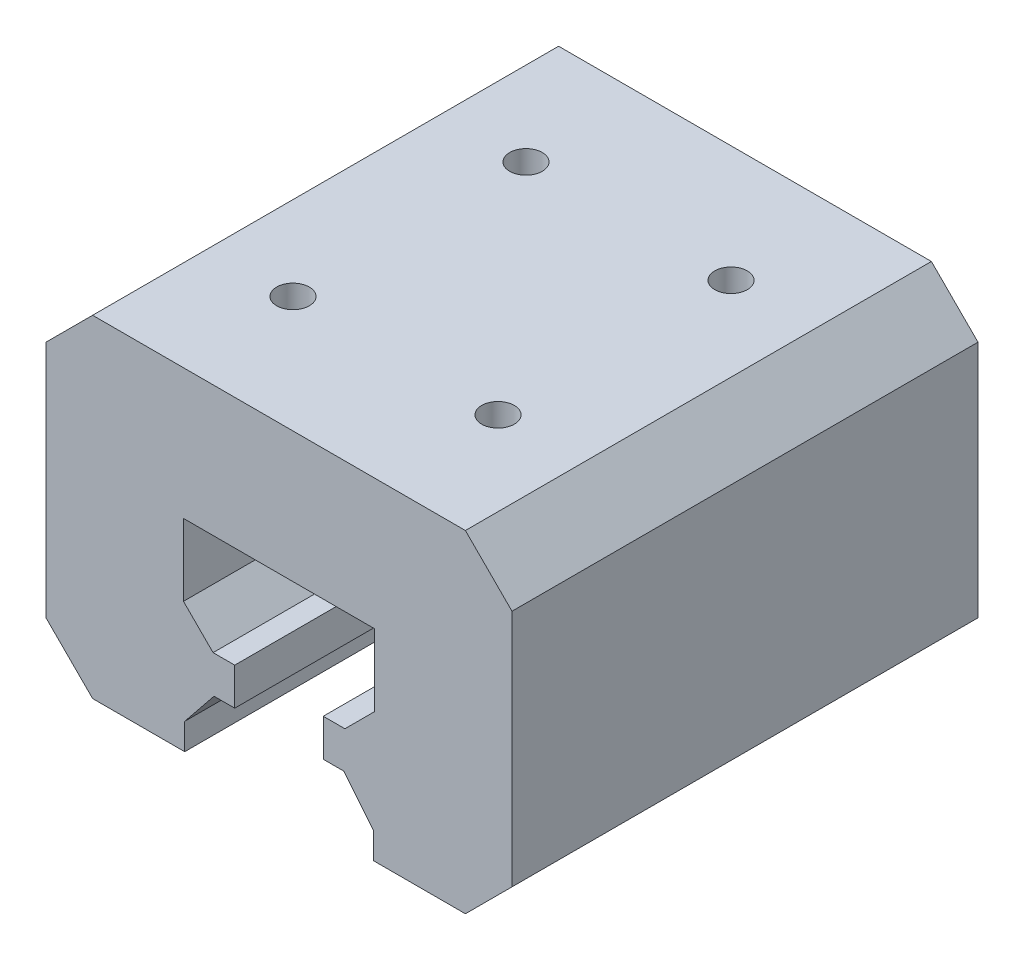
SolidWorks part; units mm, degrees
ref_plane "Płaszczyzna przednia" through (0, 0, 0) normal (0, 0, 1) x (1, 0, 0)
ref_plane "Płaszczyzna górna" through (0, 0, 0) normal (0, 1, 0) x (1, 0, 0)
ref_plane "Płaszczyzna prawa" through (0, 0, 0) normal (1, 0, 0) x (0, 0, -1)
sketch "Szkic2" plane through (0, 0, 0) normal (0, 0, 1) x (1, 0, 0)
  line L0 (-39.3077, 43.2312) -> (1.6923, 43.2312)
  line L1 (1.6923, 27.8169) -> (1.6923, 43.2312)
  line L2 (19.2, 43.2312) -> (-19.2, 43.2312) construction
  line L3 (-18.8077, 71.2312) -> (-18.8077, 43.2312) construction
  line L4 (31.1923, 71.2312) -> (-68.8077, 71.2312)
  line L5 (-68.8077, 71.2312) -> (-68.8077, 0)
  line L6 (-68.8077, 0) -> (-39.0438, 0)
  line L7 (-4.6627, 21.4619) -> (1.6923, 27.8169)
  line L8 (-9.3077, 21.4619) -> (-4.6627, 21.4619)
  line L9 (-9.3077, 13.4619) -> (-9.3077, 21.4619)
  line L10 (-4.862, 13.4619) -> (-9.3077, 13.4619)
  line L11 (1.4284, 5.6465) -> (-4.862, 13.4619)
  line L12 (1.4284, 0) -> (1.4284, 5.6465)
  line L13 (31.1923, 0) -> (1.4284, 0)
  line L14 (31.1923, 71.2312) -> (31.1923, 0)
  line L21 (-39.0438, -14.7059) -> (-39.0438, 5.2941)
  line L22 (-39.0438, 0) -> (-39.0438, 5.6465)
  line L24 (-38.8228, 5.9211) -> (-33.0536, 13.089)
  line L25 (-39.0438, 5.6465) -> (-32.7534, 13.4619)
  line L27 (-32.2746, 13.4619) -> (-27.3077, 13.4619)
  line L28 (-32.7534, 13.4619) -> (-28.3077, 13.4619)
  line L30 (-28.3077, 12.4619) -> (-28.3077, 22.4619)
  line L31 (-28.3077, 13.4619) -> (-28.3077, 21.4619)
  line L33 (-27.3077, 21.4619) -> (-32.5385, 21.4619)
  line L34 (-28.3077, 21.4619) -> (-32.9527, 21.4619)
  line L36 (-33.2456, 21.7548) -> (-39.0148, 27.5241)
  line L37 (-32.9527, 21.4619) -> (-39.3077, 27.8169)
  line L39 (-39.3077, 28.2312) -> (-39.3077, 43.2312)
  line L40 (-39.3077, 27.8169) -> (-39.3077, 43.2312)
  dimension "D2" = 41
  dimension "D3" = 1
  dimension "D4" = 28
  dimension "D5" = 100
  dimension "D6" = 71.2312
  dimension "D7" = 1
  dimension "D8" = 1
  dimension "D9" = 1
  dimension "D10" = 1
  dimension "D11" = 1
  dimension "D12" = 1
extrude "Dodanie-wyciągnięcie1" add sketch "Szkic2" along normal blind 100 contours L4 L5 L6 L22 L25 L28 L31 L34 L37 L40 L0 L1 L7 L8 L9 L10 L11 L12 L13 L14
chamfer "Sfazowanie1" distance 10 angle 45 1 edges at (31.1923, 71.2312, 50)
chamfer "Sfazowanie2" distance 10 angle 45 1 edges at (-68.8077, 71.2312, 50)
chamfer "Sfazowanie3" distance 10 angle 45 1 edges at (-68.8077, 0, 50)
chamfer "Sfazowanie4" distance 10 angle 45 1 edges at (31.1923, 0, 50)
ref_plane "Płaszczyzna1" through (-18.8077, 0, 0) normal (1, 0, 0) x (0, 0, -1)
hole_wizard "Otwór gwintowany M8x1.01" positions "Szkic4" profile "Szkic3" tap size "M8x1.0" standard "Ansi Metric"
sketch "Szkic4" plane through (0, 71.2312, 0) normal (0, 1, 0) x (1, 0, 0)
  line L0 (21.1923, 0) -> (-58.8077, 0) construction
  line L1 (-58.8077, 0) -> (-58.8077, -100) construction
  point P0 (-40.8077, -25)
  dimension "D1" = 25
  dimension "D2" = 18
sketch "Szkic3" plane through (-40.8077, 71.2312, 25) normal (1, 0, 0) x (0, 0, 1)
  line L0 (0, 0) -> (0, 23.103)
  line L1 (0, 23.103) -> (3.5, 21)
  line L2 (3.5, 21) -> (3.5, 0)
  line L5 (3.5, 0) -> (0, 0)
  line L10 (0, 23.103) -> (-3.5, 21) construction
  line L11 (0, -6.35) -> (0, 107.95) construction
  dimension "Średnica wiertła gwintu" = 7
  dimension "Głębokość otworu gwintowanego" = 21
  dimension "Kąt wiertła" = 118
mirror "Lustro1" about plane through (-18.8077, 0, 0) normal (1, 0, 0) of "Otwór gwintowany M8x1.01"
pattern_linear "Szyk liniowy1" count 2 spacing 50 along (0, 0, 1) of "Otwór gwintowany M8x1.01", "Lustro1"
